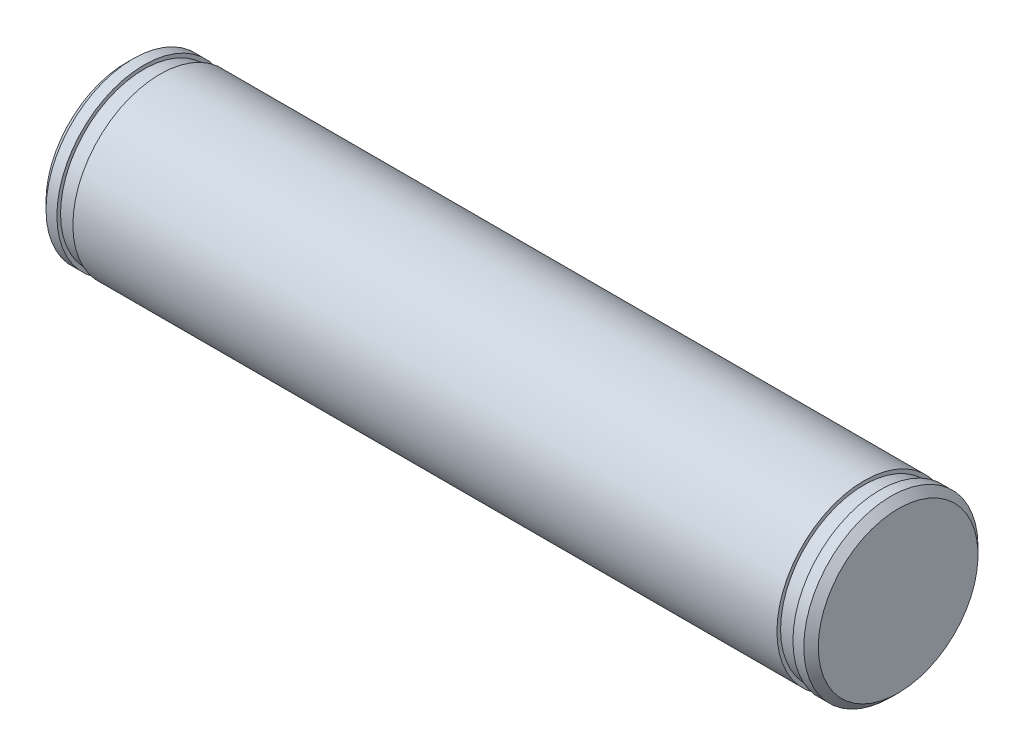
SolidWorks part; units mm, degrees
ref_plane "Plan de face" through (0, 0, 0) normal (0, 0, 1) x (1, 0, 0)
ref_plane "Plan de dessus" through (0, 0, 0) normal (0, 1, 0) x (1, 0, 0)
ref_plane "Plan de droite" through (0, 0, 0) normal (1, 0, 0) x (0, 0, -1)
sketch "Esquisse2" plane through (0, 0, 0) normal (0, 0, 1) x (1, 0, 0)
  line L0 (0, 0) -> (0, 5.5)
  line L1 (0.5, 6) -> (1.25, 6)
  line L2 (1.25, 6) -> (1.25, 5.75)
  line L3 (1.25, 5.75) -> (2.35, 5.75)
  line L4 (2.35, 5.75) -> (2.35, 6)
  line L5 (2.35, 6) -> (50.85, 6)
  line L6 (50.85, 6) -> (50.85, 5.75)
  line L7 (50.85, 5.75) -> (51.95, 5.75)
  line L8 (51.95, 5.75) -> (51.95, 6)
  line L9 (51.95, 6) -> (52.7, 6)
  line L10 (53.2, 5.5) -> (53.2, 0)
  line L11 (-14.2399, 0) -> (120.159, 0) construction
  line L12 (0, 5.5) -> (0.5, 6)
  line L13 (52.7, 6) -> (53.2, 5.5)
  line L14 (0, 0) -> (53.2, 0)
  point P1 (0, 6)
  point P12 (53.2, 6)
  dimension "D4" = 0.5
  dimension "D5" = 0.5
  dimension "D1" = 1.25
  dimension "D2" = 1.25
  dimension "D3" = 1.1
  dimension "D6" = 1.1
  dimension "D7" = 53.2
  dimension "D8" = 5.75
  dimension "D9" = 6
  dimension "D10" = 5.75
revolve "Révolution1" add sketch "Esquisse2" angle 360 about L11
